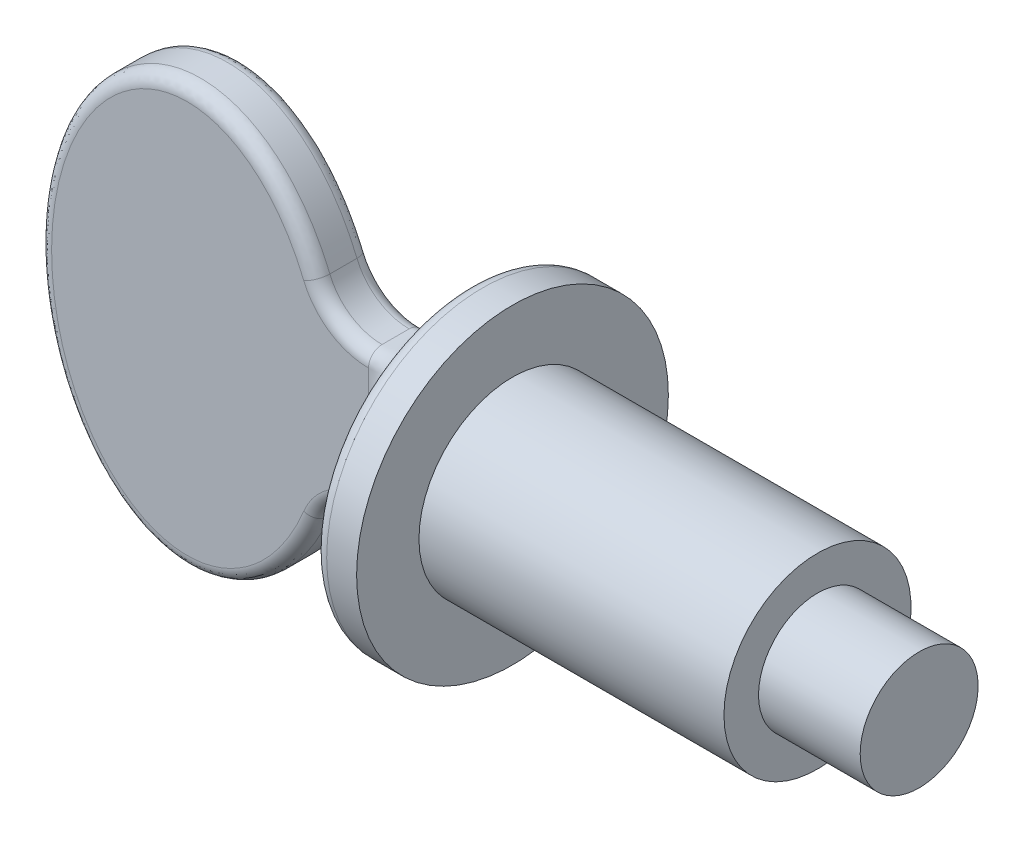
SolidWorks part; units mm, degrees
ref_plane "Front Plane" through (0, 0, 0) normal (0, 0, 1) x (1, 0, 0)
ref_plane "Top Plane" through (0, 0, 0) normal (0, 1, 0) x (1, 0, 0)
ref_plane "Right Plane" through (0, 0, 0) normal (1, 0, 0) x (0, 0, -1)
sketch "layout" plane through (0, 0, 0) normal (0, 0, 1) x (1, 0, 0)
  line L0 (0, 0) -> (13.208, 0) construction
  line L1 (5.588, 2.921) -> (5.588, -2.921)
  line L2 (3.3976, 1.3123) -> (4.8921, 1.3123) construction
  line L3 (5.588, 2.921) -> (4.7897, 2.921)
  line L4 (4.7897, 2.921) -> (4.7897, 3.2655) construction
  line L5 (4.2865, 1.706) -> (4.2865, 0)
  line L6 (4.2865, 1.706) -> (3.3355, 0.7551) construction
  line L7 (13.208, 1.7526) -> (13.208, 0)
  line L8 (3.3976, 1.3123) -> (3.3976, -1.3123)
  line L9 (13.208, 1.7526) -> (5.588, 1.7526)
  arc A0 (3.3976, 1.3123) -> (2.4197, 1.9685) centre (3.3976, 2.3692) cw
  arc A1 (4.7897, 2.921) -> (4.2865, 1.706) centre (3.0715, 2.921) cw
  arc A2 (3.3976, -1.3123) -> (2.4197, -1.9685) centre (3.3976, -2.3692) ccw
  ellipse E0 centre (0, 0) end of major axis (0, 3.937) minor radius 2.794 (2.4197, 1.9685) -> (2.4197, -1.9685) ccw
sketch "Sketch3" plane through (0, 0, 0) normal (0, 0, 1) x (1, 0, 0)
  line L0 (3.3976, 1.3123) -> (3.3976, -1.3123) construction
  line L1 (3.3976, 1.3123) -> (3.3976, -1.3123)
  arc A0 (3.3976, -1.3123) -> (2.4197, -1.9685) centre (3.3976, -2.3692) ccw construction
  arc A1 (2.4197, 1.9685) -> (3.3976, 1.3123) centre (3.3976, 2.3692) ccw construction
  arc A2 (3.3976, -1.3123) -> (2.4197, -1.9685) centre (3.3976, -2.3692) ccw
  arc A3 (2.4197, 1.9685) -> (3.3976, 1.3123) centre (3.3976, 2.3692) ccw
  ellipse E0 centre (0, 0) end of major axis (0, 3.937) minor radius 2.794 (2.4197, 1.9685) -> (2.4197, -1.9685) ccw construction
  ellipse E1 centre (0, 0) end of major axis (0, 3.937) minor radius 2.794 (2.4197, 1.9685) -> (2.4197, -1.9685) ccw
extrude "Extrude1" add sketch "Sketch3" along normal mid plane 1.016
fillet "Fillet1" radius 0.254 6 edges at (2.8088, 1.4916, -0.508) (2.8088, -1.4916, -0.508) (2.8088, 1.4916, 0.508) (2.8088, -1.4916, 0.508) (-2.794, 0, -0.508) (-2.794, 0, 0.508)
sketch "Sketch4" plane through (0, 0, 0) normal (0, 0, 1) x (1, 0, 0)
  line L0 (13.208, 1.7526) -> (13.208, 0) construction
  line L1 (13.208, 1.7526) -> (5.588, 1.7526) construction
  line L2 (5.588, 2.921) -> (5.588, -2.921) construction
  line L3 (5.588, 2.921) -> (4.7897, 2.921) construction
  line L4 (4.2865, 1.706) -> (4.2865, 0) construction
  line L5 (13.208, 1.1049) -> (13.208, 0)
  line L6 (11.303, 1.7526) -> (5.588, 1.7526)
  line L7 (5.588, 2.921) -> (5.588, 1.7526)
  line L8 (5.588, 2.921) -> (4.7897, 2.921)
  line L9 (4.2865, 1.706) -> (4.2865, 0)
  line L10 (0, 0) -> (16.8942, 0) construction
  line L11 (13.208, 0) -> (4.2865, 0)
  line L12 (13.208, 1.1049) -> (11.303, 1.1049)
  line L13 (11.303, 1.1049) -> (11.303, 1.7526)
  arc A0 (4.2865, 1.706) -> (4.7897, 2.921) centre (3.0715, 2.921) ccw construction
  arc A1 (4.2865, 1.706) -> (4.7897, 2.921) centre (3.0715, 2.921) ccw
revolve "Revolve1" add sketch "Sketch4" angle 360 about L10
loft "Loft1" add
fillet "Fillet2" radius 0.254 1 edges at (4.7897, 0, 2.921)
sketch "Sketch5" plane through (0, 0, 0) normal (0, 1, 0) x (1, 0, 0)
  line L0 (10.7575, 2.2981) -> (11.303, 2.2981)
  line L1 (11.303, 2.2981) -> (11.303, 1.7526)
  line L2 (11.303, 1.7526) -> (11.0302, 1.2802)
  line L3 (11.0302, 1.2802) -> (10.7575, 1.7526)
  line L5 (10.7575, 1.7526) -> (10.7575, 2.2981)
  line L6 (11.303, -1.7526) -> (11.303, 1.7526) construction
  line L7 (-3.6147, 0) -> (14.1406, 0) construction
  line L8 (11.303, 1.7526) -> (5.588, 1.7526) construction
revolve "Cut-Revolve10" [suppressed] cut sketch "Sketch5" angle 360 about L7
pattern_linear "LPattern10" [suppressed] count 7 along (1, 0, 0)
equation "\"D4@layout\" = \"Head Height@layout\" / 3 * 2"
equation "\"D5@layout\" = \"Head Width@layout\" / 3"
equation "\"D6@layout\" = \"Head Width@layout\" / 2"
equation "\"D7@layout\" = \"D5@layout\" * 1.3"
equation "\"D8@layout\" = \"D4@layout\"  / 7"
equation "\"D1@Fillet1\" = \"Head Thickness@Extrude1\" / 4"
equation "\"D1@Fillet2\" = \"D1@Fillet1\""
equation "\"D1@Sketch5\" = ( \"Base Screw Dia@layout\"- \"Minor Dia@Cosmetic Thread1\" )  / 2"
equation "\"D1@LPattern10\" = int((\"Length@layout\"-\"Q@Sketch4\")/\"Advance@LPattern10\")"
